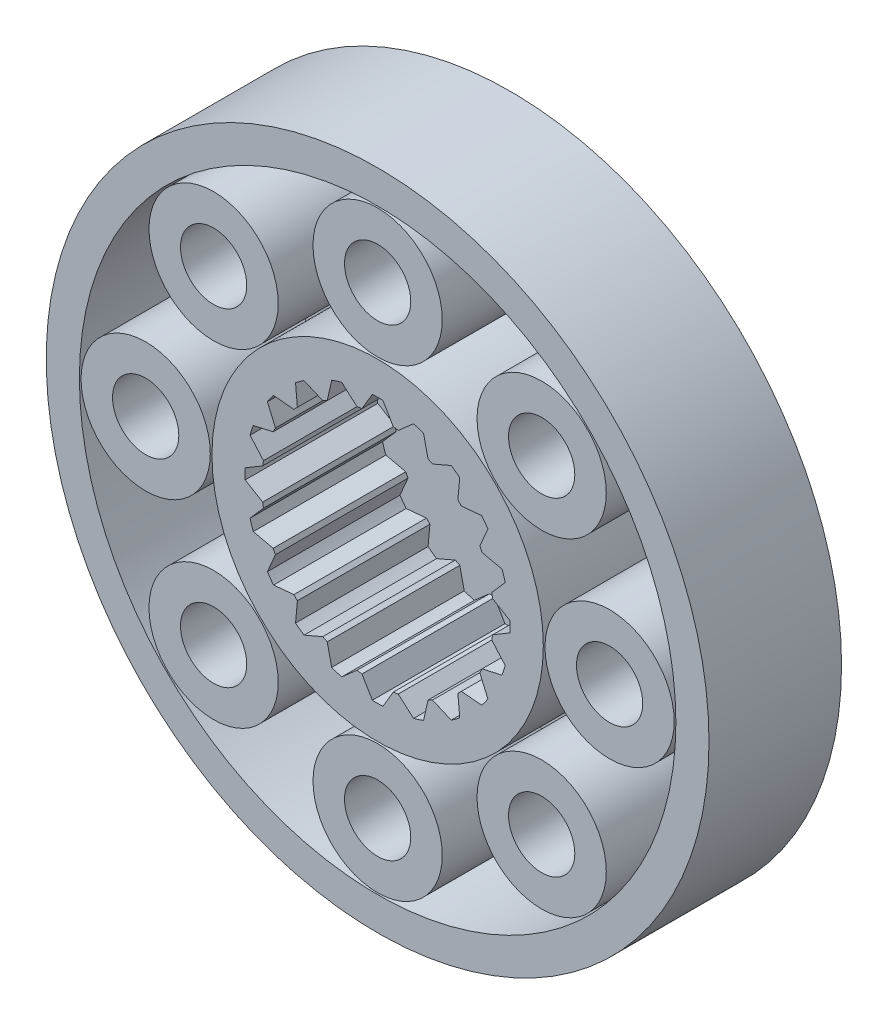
SolidWorks part; units mm, degrees
ref_plane "Front Plane" through (0, 0, 0) normal (0, 0, 1) x (1, 0, 0)
ref_plane "Top Plane" through (0, 0, 0) normal (0, 1, 0) x (1, 0, 0)
ref_plane "Right Plane" through (0, 0, 0) normal (1, 0, 0) x (0, 0, -1)
sketch "Sketch1" plane through (0, 0, 0) normal (0, 0, 1) x (1, 0, 0)
  circle A0 centre (0, 0) radius 10
  dimension "D1" = 20
extrude "Boss-Extrude1" add sketch "Sketch1" along normal blind 4
sketch "Sketch5" plane through (0, 0, 0) normal (0, 0, -1) x (-1, 0, 0)
  circle A0 centre (0, 0) radius 9
  circle A1 centre (0, 0) radius 10 construction
  circle A2 centre (0, 7) radius 1.95
  circle A3 centre (0, 0) radius 5
  circle A4 centre (4.9497, 4.9497) radius 1.95
  circle A5 centre (7, 0) radius 1.95
  circle A6 centre (4.9497, -4.9497) radius 1.95
  circle A7 centre (0, -7) radius 1.95
  circle A8 centre (-4.9497, -4.9497) radius 1.95
  circle A9 centre (-7, 0) radius 1.95
  circle A10 centre (-4.9497, 4.9497) radius 1.95
  point P24 (0, 0)
  dimension "D1" = 1
  dimension "D2" = 3.9
  dimension "D4" = 10
  dimension "D3" = 7
extrude "Cut-Extrude5" cut sketch "Sketch5" against normal up to surface (3.5 mm away) from offset 0.5 contours A7 A0 A6 A3 | A8 A0 A7 A3 | A9 A0 A8 A3 | A10 A0 A9 A3 | A10 A3 A2 A0 | A4 A0 A2 A3 | A5 A0 A4 A3 | A6 A0 A5 A3
sketch "Sketch8" plane through (0, 0, 4) normal (0, 0, 1) x (1, 0, 0)
  circle A0 centre (0, 0) radius 4
  circle A1 centre (0, 7) radius 1
  circle A2 centre (0, 0) radius 5 construction
  circle A3 centre (4.9497, 4.9497) radius 1
  circle A4 centre (7, 0) radius 1
  circle A5 centre (4.9497, -4.9497) radius 1
  circle A6 centre (0, -7) radius 1
  circle A7 centre (-4.9497, -4.9497) radius 1
  circle A8 centre (-7, 0) radius 1
  circle A9 centre (-4.9497, 4.9497) radius 1
  point P24 (0, 0)
  dimension "D1" = 2
  dimension "D2" = 1
extrude "Cut-Extrude7" cut sketch "Sketch8" against normal up to next
sketch "Sketch10" plane through (0, 0, 0) normal (0, 0, -1) x (-1, 0, 0)
  circle A0 centre (0, 0) radius 4.5
  dimension "D1" = 9
extrude "Boss-Extrude12" add sketch "Sketch10" along normal blind 0.2
fillet "Fillet2" radius 0.1 1 edges at (-4.5, 0, -0.2)
sketch "Sketch11" plane through (0, 0, -0.2) normal (0, 0, -1) x (-1, 0, 0)
  circle A0 centre (0, 0) radius 1.5
  dimension "D1" = 3
extrude "Cut-Extrude8" cut sketch "Sketch11" against normal up to next
sketch "Sketch12" plane through (0, 0, 0) normal (0, 0, 1) x (1, 0, 0)
  line L0 (-0.1587, 3.9968) -> (-0.4729, 3.4679)
  line L1 (0, 4) -> (0, 0) construction
  line L2 (0.1587, 3.9968) -> (0.4729, 3.4679)
  line L3 (1.0841, 3.8503) -> (0.6219, 3.4443)
  line L4 (1.3861, 3.7522) -> (1.5214, 3.1521)
  line L5 (2.2209, 3.3268) -> (1.6558, 3.0835)
  line L6 (2.4777, 3.1402) -> (2.4209, 2.5277)
  line L7 (3.1402, 2.4777) -> (2.5277, 2.4209)
  line L8 (3.3268, 2.2209) -> (3.0835, 1.6558)
  line L9 (3.7522, 1.3861) -> (3.1521, 1.5214)
  line L10 (3.8503, 1.0841) -> (3.4443, 0.6219)
  line L11 (3.9968, 0.1587) -> (3.4679, 0.4729)
  line L12 (3.9968, -0.1587) -> (3.4679, -0.4729)
  line L13 (3.8503, -1.0841) -> (3.4443, -0.6219)
  line L14 (3.7522, -1.3861) -> (3.1521, -1.5214)
  line L15 (3.3268, -2.2209) -> (3.0835, -1.6558)
  line L16 (3.1402, -2.4777) -> (2.5277, -2.4209)
  line L17 (2.4777, -3.1402) -> (2.4209, -2.5277)
  line L18 (2.2209, -3.3268) -> (1.6558, -3.0835)
  line L19 (1.3861, -3.7522) -> (1.5214, -3.1521)
  line L20 (1.0841, -3.8503) -> (0.6219, -3.4443)
  line L21 (0.1587, -3.9968) -> (0.4729, -3.4679)
  line L22 (-0.1587, -3.9968) -> (-0.4729, -3.4679)
  line L23 (-1.0841, -3.8503) -> (-0.6219, -3.4443)
  line L24 (-1.3861, -3.7522) -> (-1.5214, -3.1521)
  line L25 (-2.2209, -3.3268) -> (-1.6558, -3.0835)
  line L26 (-2.4777, -3.1402) -> (-2.4209, -2.5277)
  line L27 (-3.1402, -2.4777) -> (-2.5277, -2.4209)
  line L28 (-3.3268, -2.2209) -> (-3.0835, -1.6558)
  line L29 (-3.7522, -1.3861) -> (-3.1521, -1.5214)
  line L30 (-3.8503, -1.0841) -> (-3.4443, -0.6219)
  line L31 (-3.9968, -0.1587) -> (-3.4679, -0.4729)
  line L32 (-3.9968, 0.1587) -> (-3.4679, 0.4729)
  line L33 (-3.8503, 1.0841) -> (-3.4443, 0.6219)
  line L34 (-3.7522, 1.3861) -> (-3.1521, 1.5214)
  line L35 (-3.3268, 2.2209) -> (-3.0835, 1.6558)
  line L36 (-3.1402, 2.4777) -> (-2.5277, 2.4209)
  line L37 (-2.4777, 3.1402) -> (-2.4209, 2.5277)
  line L38 (-2.2209, 3.3268) -> (-1.6558, 3.0835)
  line L39 (-1.3861, 3.7522) -> (-1.5214, 3.1521)
  line L40 (-1.0841, 3.8503) -> (-0.6219, 3.4443)
  arc A0 (1.0841, 3.8503) -> (0.1587, 3.9968) centre (0, 0) ccw
  arc A1 (0.6219, 3.4443) -> (0.4729, 3.4679) centre (0, 0) ccw
  circle A2 centre (0, 0) radius 4 construction
  circle A3 centre (0, 0) radius 4 construction
  arc A4 (2.2209, 3.3268) -> (1.3861, 3.7522) centre (0, 0) ccw
  arc A5 (1.6558, 3.0835) -> (1.5214, 3.1521) centre (0, 0) ccw
  arc A6 (3.1402, 2.4777) -> (2.4777, 3.1402) centre (0, 0) ccw
  arc A7 (2.5277, 2.4209) -> (2.4209, 2.5277) centre (0, 0) ccw
  arc A8 (3.7522, 1.3861) -> (3.3268, 2.2209) centre (0, 0) ccw
  arc A9 (3.1521, 1.5214) -> (3.0835, 1.6558) centre (0, 0) ccw
  arc A10 (3.9968, 0.1587) -> (3.8503, 1.0841) centre (0, 0) ccw
  arc A11 (3.4679, 0.4729) -> (3.4443, 0.6219) centre (0, 0) ccw
  arc A12 (3.8503, -1.0841) -> (3.9968, -0.1587) centre (0, 0) ccw
  arc A13 (3.4443, -0.6219) -> (3.4679, -0.4729) centre (0, 0) ccw
  arc A14 (3.3268, -2.2209) -> (3.7522, -1.3861) centre (0, 0) ccw
  arc A15 (3.0835, -1.6558) -> (3.1521, -1.5214) centre (0, 0) ccw
  arc A16 (2.4777, -3.1402) -> (3.1402, -2.4777) centre (0, 0) ccw
  arc A17 (2.4209, -2.5277) -> (2.5277, -2.4209) centre (0, 0) ccw
  arc A18 (1.5214, -3.1521) -> (1.6558, -3.0835) centre (0, 0) ccw
  arc A19 (1.3861, -3.7522) -> (2.2209, -3.3268) centre (0, 0) ccw
  arc A20 (0.4729, -3.4679) -> (0.6219, -3.4443) centre (0, 0) ccw
  arc A21 (0.1587, -3.9968) -> (1.0841, -3.8503) centre (0, 0) ccw
  arc A22 (-0.6219, -3.4443) -> (-0.4729, -3.4679) centre (0, 0) ccw
  arc A23 (-1.0841, -3.8503) -> (-0.1587, -3.9968) centre (0, 0) ccw
  arc A24 (-1.6558, -3.0835) -> (-1.5214, -3.1521) centre (0, 0) ccw
  arc A25 (-2.2209, -3.3268) -> (-1.3861, -3.7522) centre (0, 0) ccw
  arc A26 (-2.5277, -2.4209) -> (-2.4209, -2.5277) centre (0, 0) ccw
  arc A27 (-3.1402, -2.4777) -> (-2.4777, -3.1402) centre (0, 0) ccw
  arc A28 (-3.1521, -1.5214) -> (-3.0835, -1.6558) centre (0, 0) ccw
  arc A29 (-3.7522, -1.3861) -> (-3.3268, -2.2209) centre (0, 0) ccw
  arc A30 (-3.4679, -0.4729) -> (-3.4443, -0.6219) centre (0, 0) ccw
  arc A31 (-3.9968, -0.1587) -> (-3.8503, -1.0841) centre (0, 0) ccw
  arc A32 (-3.4443, 0.6219) -> (-3.4679, 0.4729) centre (0, 0) ccw
  arc A33 (-3.8503, 1.0841) -> (-3.9968, 0.1587) centre (0, 0) ccw
  arc A34 (-3.0835, 1.6558) -> (-3.1521, 1.5214) centre (0, 0) ccw
  arc A35 (-3.3268, 2.2209) -> (-3.7522, 1.3861) centre (0, 0) ccw
  arc A36 (-2.4209, 2.5277) -> (-2.5277, 2.4209) centre (0, 0) ccw
  arc A37 (-2.4777, 3.1402) -> (-3.1402, 2.4777) centre (0, 0) ccw
  arc A38 (-1.5214, 3.1521) -> (-1.6558, 3.0835) centre (0, 0) ccw
  arc A39 (-1.3861, 3.7522) -> (-2.2209, 3.3268) centre (0, 0) ccw
  arc A40 (-0.4729, 3.4679) -> (-0.6219, 3.4443) centre (0, 0) ccw
  arc A41 (-0.1587, 3.9968) -> (-1.0841, 3.8503) centre (0, 0) ccw
  point P91 (0, 0)
  dimension "D1" = 0.5
  dimension "D2" = 20
extrude "Boss-Extrude13" add sketch "Sketch12" along normal blind 4
